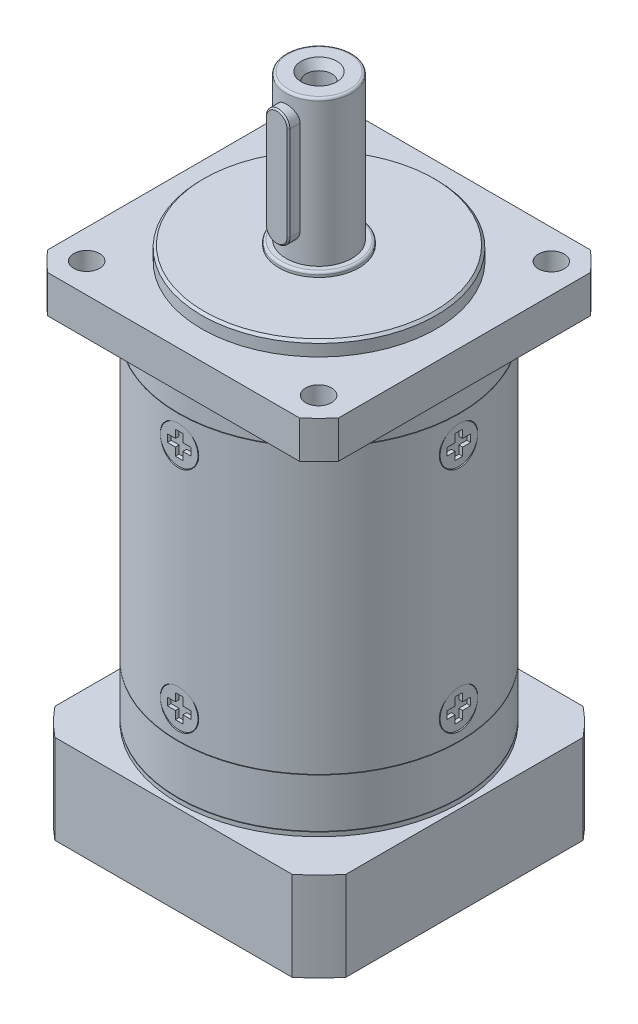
SolidWorks part; units mm, degrees
ref_plane "前视基准面" through (0, 0, 0) normal (0, 0, 1) x (1, 0, 0)
ref_plane "上视基准面" through (0, 0, 0) normal (0, 1, 0) x (1, 0, 0)
ref_plane "右视基准面" through (0, 0, 0) normal (1, 0, 0) x (0, 0, -1)
sketch "草图1" plane through (0, 0, 0) normal (0, 1, 0) x (1, 0, 0)
  circle A0 centre (0, 0) radius 25
extrude "凸台-拉伸1" add sketch "草图1" along normal blind 3
sketch "草图2" plane through (0, 0, 0) normal (0, -1, 0) x (1, 0, 0)
  circle A0 centre (0, 0) radius 30
extrude "凸台-拉伸2" add sketch "草图2" along normal blind 13
ref_plane "基准面1" through (0, -13.1, 0) normal (0, -1, 0) x (1, 0, 0)
sketch "草图3" plane through (0, -13.1, 0) normal (0, -1, 0) x (1, 0, 0)
  circle A0 centre (0, 0) radius 30
extrude "凸台-拉伸3" add sketch "草图3" along normal blind 60.4 separate body
ref_plane "基准面2" through (0, -73.6, 0) normal (0, -1, 0) x (1, 0, 0)
sketch "草图4" plane through (0, -73.6, 0) normal (0, -1, 0) x (1, 0, 0)
  circle A0 centre (0, 0) radius 30
extrude "凸台-拉伸4" add sketch "草图4" along normal blind 10.4 separate body
ref_plane "基准面3" through (0, -84.1, 0) normal (0, -1, 0) x (1, 0, 0)
sketch "草图5" plane through (0, -84.1, 0) normal (0, -1, 0) x (1, 0, 0)
  circle A0 centre (0, 0) radius 30
extrude "凸台-拉伸5" add sketch "草图5" along normal blind 0.9 separate body
sketch "草图6" plane through (0, -85, 0) normal (0, -1, 0) x (1, 0, 0)
  line L1 (-25.2784, 31) -> (25.2784, 31)
  line L2 (-31, 25.2784) -> (-31, -25.2784)
  line L3 (-25.2784, -31) -> (25.2784, -31)
  line L4 (31, 25.2784) -> (31, -25.2784)
  arc A0 (-25.2784, 31) -> (-31, 25.2784) centre (0, 0) ccw
  arc A1 (-31, -25.2784) -> (-25.2784, -31) centre (0, 0) ccw
  arc A2 (25.2784, -31) -> (31, -25.2784) centre (0, 0) ccw
  arc A3 (31, 25.2784) -> (25.2784, 31) centre (0, 0) ccw
  dimension "D1" = 31
  dimension "D3" = 31
extrude "凸台-拉伸6" add sketch "草图6" along normal blind 19
sketch "草图7" plane through (0, -104, 0) normal (0, -1, 0) x (1, 0, 0)
  circle A0 centre (0, 0) radius 25
extrude "切除-拉伸1" cut sketch "草图7" against normal blind 5
sketch "草图8" plane through (0, -99, 0) normal (0, -1, 0) x (1, 0, 0)
  circle A0 centre (0, 0) radius 17.5
extrude "切除-拉伸2" cut sketch "草图8" against normal blind 19
ref_plane "基准面4" through (0, -97, 0) normal (0, -1, 0) x (1, 0, 0)
sketch "草图9" plane through (0, -97, 0) normal (0, -1, 0) x (1, 0, 0)
  circle A0 centre (0, 0) radius 16
extrude "凸台-拉伸7" add sketch "草图9" against normal up to surface (17 mm away)
chamfer "倒角1" distance 1 angle 45 1 edges at (0, -97, -16)
sketch "草图10" plane through (0, -104, 0) normal (0, -1, 0) x (1, 0, 0)
  circle A0 centre (0, 0) radius 7
extrude "切除-拉伸3" cut sketch "草图10" against normal blind 32
sketch "草图11" plane through (0, -97, 0) normal (0, -1, 0) x (1, 0, 0)
  line L1 (-16.7216, 0.5) -> (16.9728, 0.5)
  line L2 (-16.7216, 0.5) -> (-16.7216, -0.5)
  line L3 (-16.7216, -0.5) -> (16.9728, -0.5)
  line L4 (16.9728, 0.5) -> (16.9728, -0.5)
  dimension "D1" = 0.5
  dimension "D2" = 1
extrude "切除-拉伸4" cut sketch "草图11" against normal up to surface (17 mm away)
sketch "草图12" plane through (0, -104, 0) normal (0, -1, 0) x (1, 0, 0)
  line L0 (0, 0) -> (0, 25.5) construction
  line L1 (0, 0) -> (-12.75, 22.0836) construction
  circle A0 centre (0, 0) radius 25.5 construction
  circle A1 centre (-12.75, 22.0836) radius 4
  dimension "D1" = 30
extrude "切除-拉伸5" cut sketch "草图12" against normal blind 12
pattern_circular "阵列(圆周)1" count 4 over 360 about axis through (0, 0, 0) along (0, 1, 0) of "切除-拉伸5"
chamfer "倒角3" distance 0.5 angle 45 1 edges at (0, 3, 25)
sketch "草图13" plane through (0, -104, 0) normal (0, -1, 0) x (1, 0, 0)
  line L0 (0, 0) -> (-24.7487, -24.7487)
  circle A0 centre (0, 0) radius 35
hole_wizard "M4 螺纹孔1" positions "3D草图1" profile "草图14" tap size "M4" standard "GB"
sketch3d "3D草图1"
  point P0 (-24.7487, -104, -24.7487)
sketch "草图14" plane through (-24.7487, -104, -24.7487) normal (1, 0, 0) x (0, 0, -1)
  line L0 (0, 0) -> (0, 14.4914)
  line L1 (0, 14.4914) -> (1.65, 13.5)
  line L2 (1.65, 13.5) -> (1.65, 0)
  line L5 (1.65, 0) -> (0, 0)
  line L10 (0, 14.4914) -> (-1.65, 13.5) construction
  line L11 (0, -6.35) -> (0, 107.95) construction
  dimension "螺纹孔钻头直径" = 3.3
  dimension "螺纹孔钻头深度" = 13.5
  dimension "导头角度" = 118
pattern_circular "阵列(圆周)2" count 4 over 360 about axis through (0, 0, 0) along (0, 1, 0) of "M4 螺纹孔1"
sketch "草图15" plane through (0, 3, 0) normal (0, 1, 0) x (1, 0, 0)
  circle A0 centre (0, 0) radius 8.5
extrude "凸台-拉伸8" add sketch "草图15" along normal blind 1
sketch "草图16" plane through (0, 4, 0) normal (0, 1, 0) x (1, 0, 0)
  circle A0 centre (0, 0) radius 7
extrude "凸台-拉伸9" add sketch "草图16" along normal blind 31
fillet "圆角1" radius 0.5 1 edges at (0, 4, 8.5)
fillet "圆角2" radius 0.5 1 edges at (0, 35, 7)
ref_plane "基准面5" through (0, 0, 30) normal (0, 0, 1) x (1, 0, 0)
ref_plane "基准面6" through (0, 0, 29) normal (0, 0, 1) x (1, 0, 0)
sketch "草图19" plane through (0, 0, 29) normal (0, 0, 1) x (1, 0, 0)
  line L0 (-30, -13) -> (30, -13) construction
  line L1 (30, -73.6) -> (-30, -73.6) construction
  circle A0 centre (0, -19) radius 4.1
  circle A1 centre (0, -67.6) radius 4.1
  dimension "D1" = 6
  dimension "D2" = 6
extrude "切除-拉伸6" cut sketch "草图19" along normal blind 31
pattern_circular "阵列(圆周)5" count 4 over 360 about axis through (0, 0, 0) along (0, 1, 0) of "切除-拉伸6"
sketch "草图20" plane through (0, 0, 29) normal (0, 0, 1) x (1, 0, 0)
  line L0 (0.8, -19.8) -> (0.8, -21.5)
  line L1 (-0.8, -16.5) -> (0.8, -16.5)
  line L2 (-0.8, -16.5) -> (-0.8, -18.2)
  line L3 (-0.8, -21.5) -> (0.8, -21.5)
  line L4 (0.8, -16.5) -> (0.8, -18.2)
  line L5 (-2.5, -18.2) -> (-0.8, -18.2)
  line L6 (-2.5, -18.2) -> (-2.5, -19.8)
  line L7 (-2.5, -19.8) -> (-0.8, -19.8)
  line L8 (2.5, -18.2) -> (2.5, -19.8)
  line L9 (-0.8, -19.8) -> (-0.8, -21.5)
  line L10 (0.8, -18.2) -> (2.5, -18.2)
  line L11 (0.8, -19.8) -> (2.5, -19.8)
  line L12 (0.8, -68.4) -> (0.8, -70.1)
  line L13 (-2.5, -66.8) -> (-0.8, -66.8)
  line L14 (-2.5, -66.8) -> (-2.5, -68.4)
  line L15 (-2.5, -68.4) -> (-0.8, -68.4)
  line L16 (2.5, -66.8) -> (2.5, -68.4)
  line L17 (-0.8, -65.1) -> (0.8, -65.1)
  line L18 (-0.8, -65.1) -> (-0.8, -66.8)
  line L19 (-0.8, -70.1) -> (0.8, -70.1)
  line L20 (0.8, -65.1) -> (0.8, -66.8)
  line L21 (-0.8, -68.4) -> (-0.8, -70.1)
  line L22 (0.8, -66.8) -> (2.5, -66.8)
  line L23 (0.8, -68.4) -> (2.5, -68.4)
  circle A0 centre (0, -19) radius 4
  circle A1 centre (0, -67.6) radius 4
  dimension "D1" = 0.8
  dimension "D9" = 0.8
  dimension "D2" = 1.6
  dimension "D3" = 0.8
  dimension "D4" = 1.6
  dimension "D5" = 2.5
  dimension "D6" = 5
  dimension "D7" = 2.5
  dimension "D8" = 5
  dimension "D10" = 1.6
  dimension "D11" = 0.8
  dimension "D12" = 1.6
  dimension "D13" = 2.5
  dimension "D14" = 5
  dimension "D15" = 2.5
  dimension "D16" = 5
extrude "凸台-拉伸10" add sketch "草图20" along normal blind 0.8
pattern_circular "阵列(圆周)21" count 4 over 360 about axis through (0, 0, 0) along (0, 1, 0) of "凸台-拉伸10"
sketch "草图21" plane through (0, -92, 0) normal (0, -1, 0) x (1, 0, 0)
  line L1 (-11.8663, 23.5733) -> (-13.5983, 23.5938)
  line L2 (-13.5983, 23.5938) -> (-14.4819, 22.1041)
  line L3 (-14.4819, 22.1041) -> (-13.6337, 20.594)
  line L4 (-13.6337, 20.594) -> (-11.9017, 20.5735)
  line L5 (-11.9017, 20.5735) -> (-11.0181, 22.0632)
  line L6 (-11.0181, 22.0632) -> (-11.8663, 23.5733)
  circle A0 centre (-12.75, 22.0836) radius 3.5
  circle A1 centre (-12.75, 22.0836) radius 1.5 construction
  dimension "D1" = 3
extrude "凸台-拉伸11" add sketch "草图21" along normal blind 4
pattern_circular "阵列(圆周)22" count 4 over 360 about axis through (0, 0, 0) along (0, 1, 0) of "凸台-拉伸11"
sketch "草图22" plane through (0, 0, 0) normal (0, 0, 1) x (1, 0, 0)
  line L0 (6.5, 35) -> (-6.5, 35) construction
  line L1 (-2.5, 30) -> (-2.5, 10)
  line L2 (2.5, 30) -> (2.5, 10)
  arc A0 (2.5, 30) -> (-2.5, 30) centre (0, 30) ccw
  arc A1 (-2.5, 10) -> (2.5, 10) centre (0, 10) ccw
  dimension "D1" = 5
  dimension "D2" = 20
extrude "凸台-拉伸12" add sketch "草图22" along normal blind 9
chamfer "倒角4" distance 0.3 angle 45 4 edges at (-2.5, 20, 9) (0, 7.5, 9) (0, 32.5, 9) (2.5, 20, 9)
sketch "草图23" plane through (0, 0, 0) normal (0, 1, 0) x (1, 0, 0)
  line L1 (-26.8328, 31) -> (26.8328, 31)
  line L2 (-31, 26.8328) -> (-31, -26.8328)
  line L3 (-26.8328, -31) -> (26.8328, -31)
  line L4 (31, 26.8328) -> (31, -26.8328)
  circle A0 centre (0, 0) radius 29.5
  arc A1 (-26.8328, 31) -> (-31, 26.8328) centre (0, 0) ccw
  arc A2 (-31, -26.8328) -> (-26.8328, -31) centre (0, 0) ccw
  arc A3 (26.8328, -31) -> (31, -26.8328) centre (0, 0) ccw
  arc A4 (31, 26.8328) -> (26.8328, 31) centre (0, 0) ccw
  dimension "D1" = 31
  dimension "D2" = 59
  dimension "D6" = 41
  dimension "D3" = 31
  dimension "D4" = 62
  dimension "D5" = 62
extrude "凸台-拉伸13" add sketch "草图23" against normal blind 8 separate body
combine bodies "组合1" operation type add bodies to combine 137 136
sketch "草图24" plane through (0, 0, 0) normal (0, 1, 0) x (1, 0, 0)
  line L0 (0, 0.5964) -> (-28.9914, 28.9914) construction
  circle A0 centre (0, 0) radius 35 construction
  arc A1 (-26.8328, 31) -> (-31, 26.8328) centre (0, 0) ccw construction
  circle A3 centre (-24.7046, 24.7928) radius 2.75
extrude "切除-拉伸7" cut sketch "草图24" against normal blind 8
pattern_circular "阵列(圆周)23" count 4 over 360 about axis through (0, 0, 0) along (0, 1, 0) of "切除-拉伸7"
sketch "草图25" plane through (0, 35, 0) normal (0, 1, 0) x (1, 0, 0)
  circle A0 centre (0, 0) radius 2.75
extrude "切除-拉伸8" cut sketch "草图25" against normal blind 4.8
ref_plane "基准面7" through (0, 33.2, 0) normal (0, 1, 0) x (-1, 0, 0)
sketch "草图26" plane through (0, 33.2, 0) normal (0, 1, 0) x (-1, 0, 0)
  circle A0 centre (0, 0) radius 2.75 construction
  circle A1 centre (0, 0) radius 2.75
sketch "草图27" plane through (0, 35, 0) normal (0, 1, 0) x (1, 0, 0)
  circle A0 centre (0, 0) radius 3.8
loft "切除-放样1" cut profiles "草图26", "草图27"
hole_wizard "M5 螺纹孔1" positions "3D草图2" profile "草图28" tap size "M5" standard "GB"
sketch3d "3D草图2"
  line L0 (0, 30.2, 0) -> (0, 33.2, 0) construction
  point P0 (0, 30.2, 0)
sketch "草图28" plane through (0, 30.2, 0) normal (1, 0, 0) x (0, 0, 1)
  line L0 (0, 0) -> (0, 12.9618)
  line L1 (0, 12.9618) -> (2.1, 11.7)
  line L2 (2.1, 11.7) -> (2.1, 0)
  line L5 (2.1, 0) -> (0, 0)
  line L10 (0, 12.9618) -> (-2.1, 11.7) construction
  line L11 (0, -6.35) -> (0, 107.95) construction
  dimension "螺纹孔钻头直径" = 4.2
  dimension "螺纹孔钻头深度" = 11.7
  dimension "导头角度" = 118
